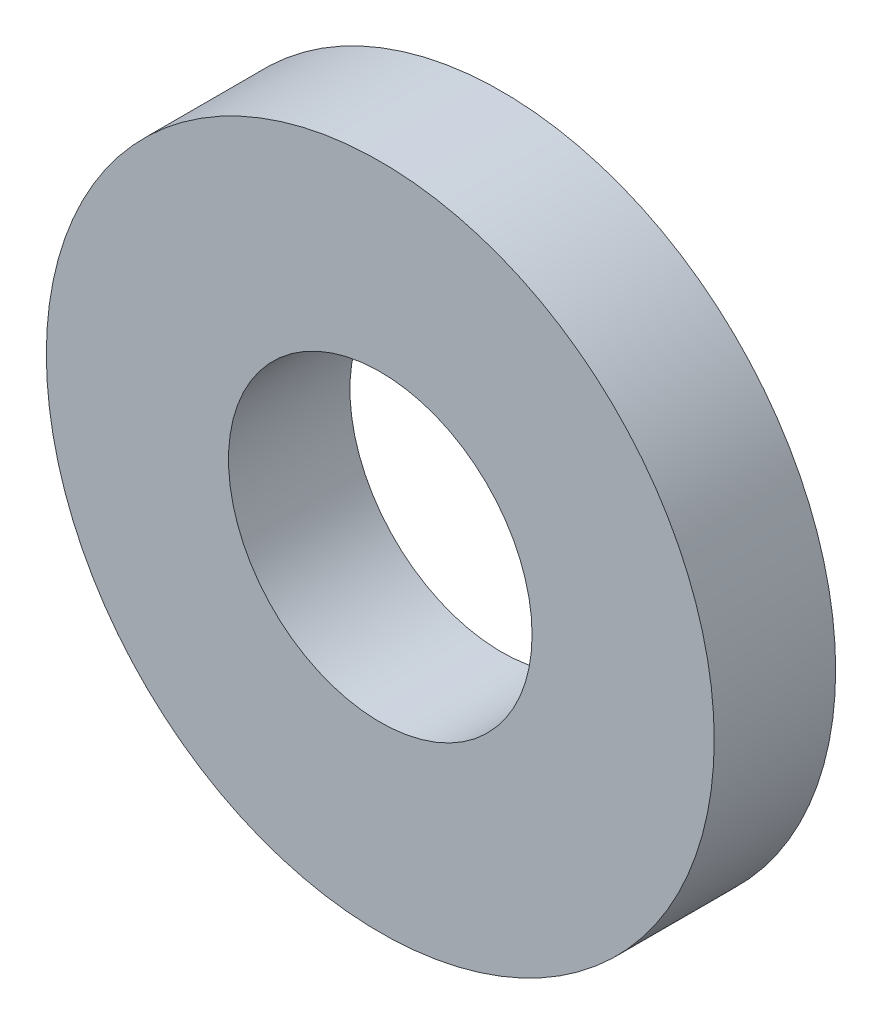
SolidWorks part; units mm, degrees
ref_plane "Front Plane" through (0, 0, 0) normal (0, 0, 1) x (1, 0, 0)
ref_plane "Top Plane" through (0, 0, 0) normal (0, 1, 0) x (1, 0, 0)
ref_plane "Right Plane" through (0, 0, 0) normal (1, 0, 0) x (0, 0, -1)
sketch "Sketch1" plane through (0, 0, 0) normal (0, 0, 1) x (1, 0, 0)
  circle A0 centre (0.2438, 0) radius 11
  circle A1 centre (0.2438, 0) radius 5
  dimension "D1" = 10
  dimension "D2" = 22
extrude "Boss-Extrude1" add sketch "Sketch1" along normal blind 4
